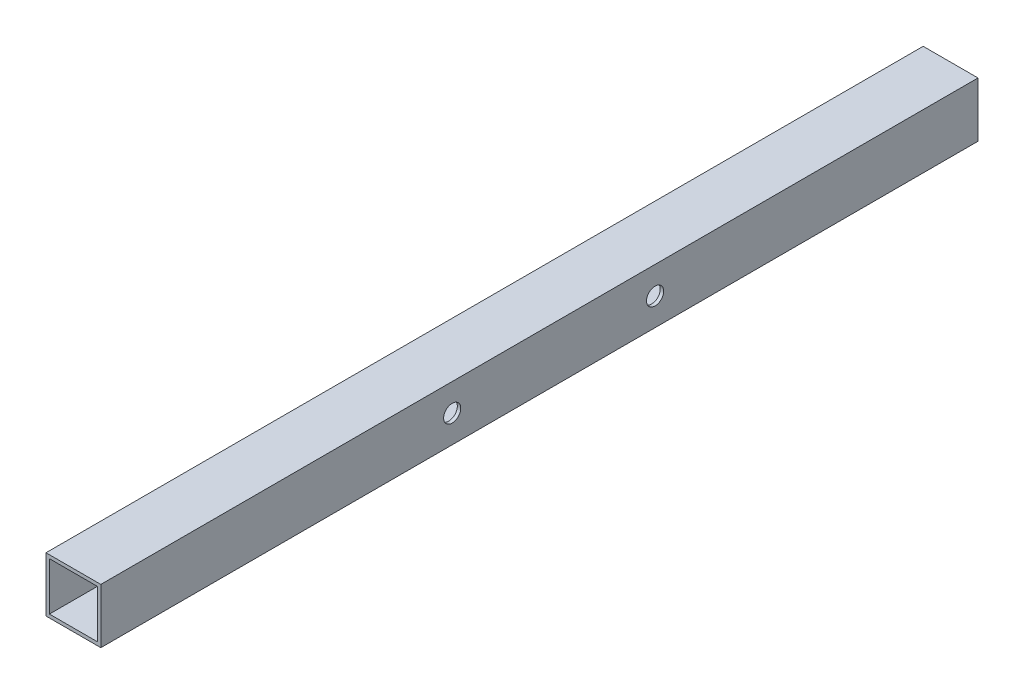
SolidWorks part; units mm, degrees
ref_plane "Front Plane" through (0, 0, 0) normal (0, 0, 1) x (1, 0, 0)
ref_plane "Top Plane" through (0, 0, 0) normal (0, 1, 0) x (1, 0, 0)
ref_plane "Right Plane" through (0, 0, 0) normal (1, 0, 0) x (0, 0, -1)
sketch "Sketch1" plane through (0, 0, 0) normal (0, 0, 1) x (1, 0, 0)
  line L0 (-22.225, -22.225) -> (-22.225, 22.225)
  line L1 (-25.4, -25.4) -> (25.4, -25.4)
  line L2 (-25.4, -25.4) -> (-25.4, 25.4)
  line L3 (-25.4, 25.4) -> (25.4, 25.4)
  line L4 (25.4, -25.4) -> (25.4, 25.4)
  line L5 (-22.225, 22.225) -> (22.225, 22.225)
  line L6 (22.225, -22.225) -> (22.225, 22.225)
  line L7 (-22.225, -22.225) -> (22.225, -22.225)
  dimension "D1" = 50.8
  dimension "D2" = 50.8
  dimension "D3" = 25.4
  dimension "D4" = 25.4
  dimension "D5" = 3.175
extrude "Boss-Extrude1" add sketch "Sketch1" against normal blind 812.8
sketch "Sketch3" plane through (25.4, 0, 0) normal (1, 0, 0) x (0, 0, -1)
  line L0 (812.8, 25.4) -> (0, 25.4) construction
  circle A0 centre (325.5772, 0) radius 7.9375
  circle A1 centre (513.588, 0) radius 7.9375
  point P4 (406.4, 25.4)
  dimension "D1" = 15.875
  dimension "D2" = 15.875
  dimension "D3" = 188.0108
  dimension "D4" = 80.8228
extrude "Cut-Extrude1" cut sketch "Sketch3" against normal through all
